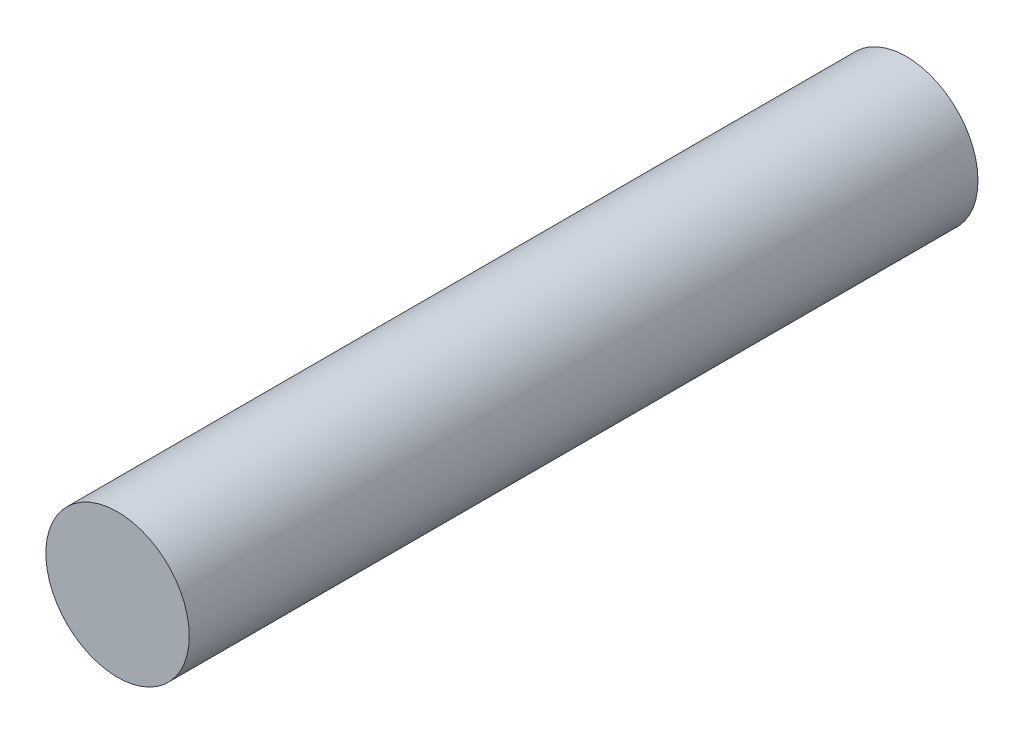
SolidWorks part; units mm, degrees
ref_plane "Front" through (0, 0, 0) normal (0, 0, 1) x (1, 0, 0)
ref_plane "Top" through (0, 0, 0) normal (0, 1, 0) x (1, 0, 0)
ref_plane "Right" through (0, 0, 0) normal (1, 0, 0) x (0, 0, -1)
sketch "Sketch1" plane through (0, 0, 0) normal (0, 0, 1) x (1, 0, 0)
  circle A0 centre (0, 0) radius 1.5
  dimension "D1" = 3
extrude "Boss-Extrude1" add sketch "Sketch1" along normal blind 16.5
